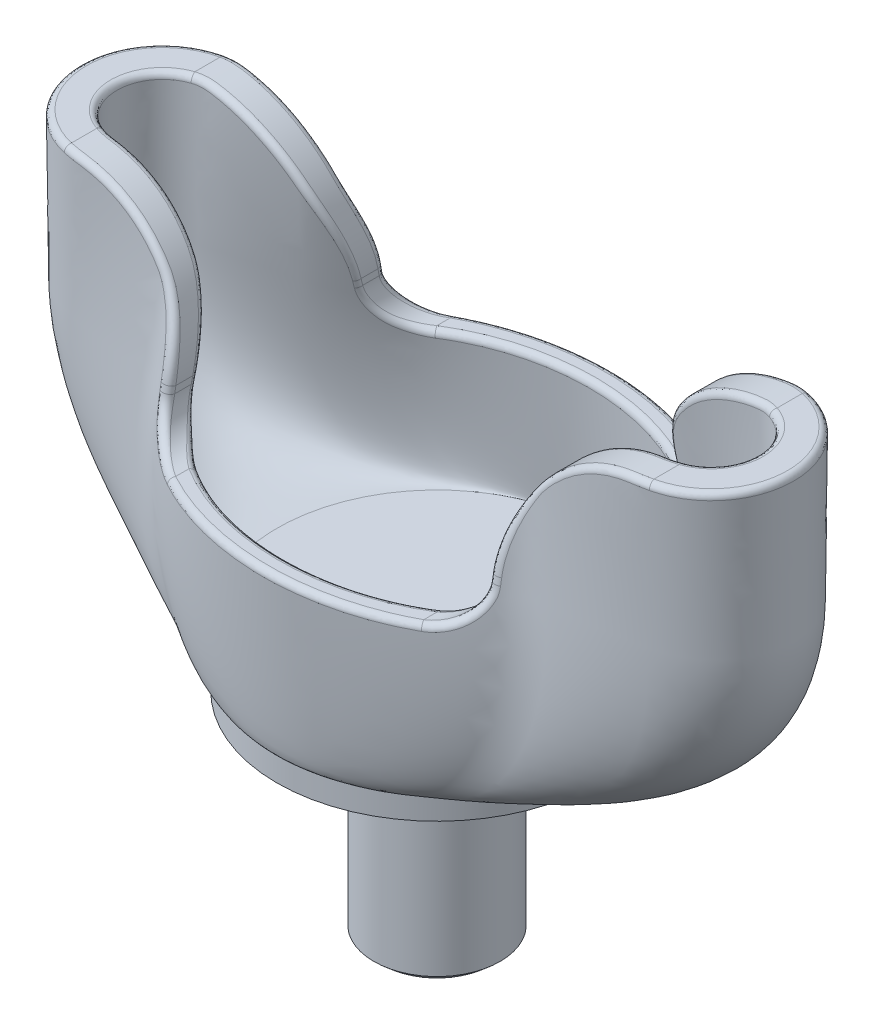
SolidWorks part; units mm, degrees
ref_plane "Front Plane" through (0, 0, 0) normal (0, 0, 1) x (1, 0, 0)
ref_plane "Top Plane" through (0, 0, 0) normal (0, 1, 0) x (1, 0, 0)
ref_plane "Right Plane" through (0, 0, 0) normal (1, 0, 0) x (0, 0, -1)
other "Configuration Table"
sketch "Sketch1" plane through (0, 0, 0) normal (0, 0, 1) x (1, 0, 0)
  line L0 (0, 10.7344) -> (0, -7.5424) construction
  line L1 (4.445, 5.334) -> (4.445, 6.5193)
  line L2 (-4.445, 0) -> (4.445, 0)
  line L3 (9.906, 10.16) -> (8.0857, 10.16)
  line L4 (-4.445, 5.334) -> (4.445, 5.334)
  line L5 (9.906, 10.16) -> (8.3762, 10.16) construction
  line L6 (9.906, 10.16) -> (9.906, 5.7504) construction
  line L7 (9.906, 10.16) -> (9.906, 6.1278)
  line L8 (4.445, 0) -> (4.445, 0.6667)
  line L9 (4.445, 0.6667) -> (0.3077, 0.6667) construction
  line L10 (-4.445, 0) -> (-4.445, 0.6667)
  line L11 (-9.906, 10.16) -> (-9.906, 6.1277)
  line L12 (-9.906, 10.16) -> (-8.0857, 10.16)
  line L13 (-4.445, 5.334) -> (-4.445, 6.5193)
  arc A5 (8.0857, 10.16) -> (4.445, 6.5193) centre (8.0857, 6.5193) ccw
  arc A6 (4.445, 0.6667) -> (9.906, 6.1278) centre (4.445, 6.1277) ccw
  arc A7 (-8.0857, 10.16) -> (-4.445, 6.5193) centre (-8.0857, 6.5193) cw
  arc A8 (-4.445, 0.6667) -> (-9.906, 6.1277) centre (-4.445, 6.1277) cw
  point P4 (0, 5.334)
  point P19 (0, 0)
ref_plane "Plane4" through (0, 10.16, 0) normal (0, 1, 0) x (-1, 0, 0)
ref_plane "Plane5" through (0, 0.6667, 0) normal (0, 1, 0) x (-1, 0, 0)
sketch "Sketch2" plane through (0, 10.16, 0) normal (0, 1, 0) x (-1, 0, 0)
  line L0 (4.445, 0) -> (-4.445, 0) construction
  line L1 (5.1243, -2.286) -> (7.62, -2.286)
  line L2 (0, 0) -> (14.2067, 0) construction
  line L3 (5.1243, 2.286) -> (7.62, 2.286)
  line L4 (0, 0) -> (0, 10.869) construction
  line L5 (0, 0) -> (0, -9.6836) construction
  line L6 (-5.1243, 2.286) -> (-7.62, 2.286)
  line L7 (-5.1243, -2.286) -> (-7.62, -2.286)
  arc A0 (4.2702, 2.7517) -> (-4.2702, 2.7517) centre (0, 0) ccw
  arc A1 (7.62, 2.286) -> (7.62, -2.286) centre (7.62, 0) cw
  arc A2 (-4.2702, -2.7517) -> (4.2702, -2.7517) centre (0, 0) ccw
  arc A3 (-7.62, 2.286) -> (-7.62, -2.286) centre (-7.62, 0) ccw
  arc A4 (-5.1243, 2.286) -> (-4.2702, 2.7517) centre (-5.1243, 3.302) ccw
  arc A5 (-5.1243, -2.286) -> (-4.2702, -2.7517) centre (-5.1243, -3.302) cw
  arc A6 (5.1243, 2.286) -> (4.2702, 2.7517) centre (5.1243, 3.302) cw
  arc A7 (5.1243, -2.286) -> (4.2702, -2.7517) centre (5.1243, -3.302) ccw
  point P20 (-4.5366, 2.286)
  point P23 (-4.5366, -2.286)
  point P26 (4.5366, 2.286)
  point P29 (4.5366, -2.286)
  dimension "F" = 10.16
  dimension "C" = 4.572
sketch "Sketch9" plane through (0, 0, 0) normal (0, 0, 1) x (1, 0, 0)
  line L0 (-9.906, 10.16) -> (-9.906, 6.1277) construction
  line L1 (-9.906, 10.16) -> (-9.906, 6.1277)
  arc A0 (-9.906, 6.1277) -> (-4.445, 0.6667) centre (-4.445, 6.1277) ccw construction
  arc A2 (-9.906, 6.1277) -> (-4.445, 0.6667) centre (-4.445, 6.1277) ccw
sketch "Sketch10" plane through (0, 0, 0) normal (0, 0, 1) x (1, 0, 0)
  line L0 (9.906, 10.16) -> (9.906, 6.1277) construction
  line L1 (9.906, 10.16) -> (9.906, 6.1277)
  arc A1 (4.445, 0.6668) -> (9.906, 6.1277) centre (4.445, 6.1277) ccw construction
  arc A2 (4.445, 0.6668) -> (9.906, 6.1277) centre (4.445, 6.1277) ccw
sketch "Sketch18" plane through (0, 0.6667, 0) normal (0, 1, 0) x (-1, 0, 0)
  circle A0 centre (0, 0) radius 4.445
loft "Loft2" add profiles "Sketch18", "Sketch2"
ref_plane "Plane6" through (0, 1.6827, 0) normal (0, 1, 0) x (-1, 0, 0)
sketch "Sketch20" plane through (0, 1.6827, 0) normal (0, 1, 0) x (-1, 0, 0)
  circle A0 centre (0, 0) radius 4.445 construction
  circle A1 centre (0, 0) radius 4.445
sketch "Sketch21" plane through (0, 10.16, 0) normal (0, 1, 0) x (-1, 0, 0)
  line L8 (-5.1243, 1.27) -> (-7.62, 1.27)
  line L9 (-7.62, -1.27) -> (-5.1243, -1.27)
  line L10 (5.1243, -1.27) -> (7.62, -1.27)
  line L11 (7.62, 1.27) -> (5.1243, 1.27)
  line L12 (-5.1243, 1.27) -> (-7.62, 1.27)
  line L13 (-7.62, -1.27) -> (-5.1243, -1.27)
  line L14 (5.1243, -1.27) -> (7.62, -1.27)
  line L15 (7.62, 1.27) -> (5.1243, 1.27)
  arc A16 (-7.62, 1.27) -> (-7.62, -1.27) centre (-7.62, 0) ccw
  arc A17 (-3.4162, -2.2013) -> (-5.1243, -1.27) centre (-5.1243, -3.302) ccw
  arc A18 (-3.4162, -2.2013) -> (3.4162, -2.2013) centre (0, 0) ccw
  arc A19 (5.1243, -1.27) -> (3.4162, -2.2013) centre (5.1243, -3.302) ccw
  arc A20 (7.62, -1.27) -> (7.62, 1.27) centre (7.62, 0) ccw
  arc A21 (3.4162, 2.2013) -> (5.1243, 1.27) centre (5.1243, 3.302) ccw
  arc A22 (3.4162, 2.2013) -> (-3.4162, 2.2013) centre (0, 0) ccw
  arc A23 (-5.1243, 1.27) -> (-3.4162, 2.2013) centre (-5.1243, 3.302) ccw
  arc A24 (-7.62, 1.27) -> (-7.62, -1.27) centre (-7.62, 0) ccw
  arc A25 (-3.4162, -2.2013) -> (-5.1243, -1.27) centre (-5.1243, -3.302) ccw
  arc A26 (-3.4162, -2.2013) -> (3.4162, -2.2013) centre (0, 0) ccw
  arc A27 (5.1243, -1.27) -> (3.4162, -2.2013) centre (5.1243, -3.302) ccw
  arc A28 (7.62, -1.27) -> (7.62, 1.27) centre (7.62, 0) ccw
  arc A29 (3.4162, 2.2013) -> (5.1243, 1.27) centre (5.1243, 3.302) ccw
  arc A30 (3.4162, 2.2013) -> (-3.4162, 2.2013) centre (0, 0) ccw
  arc A31 (-5.1243, 1.27) -> (-3.4162, 2.2013) centre (-5.1243, 3.302) ccw
sketch "Sketch22" plane through (0, 0, 0) normal (0, 0, 1) x (1, 0, 0)
  line L2 (-8.89, 10.16) -> (-8.89, 6.1277)
  line L3 (-8.89, 10.16) -> (-8.89, 6.1277)
  arc A2 (-8.89, 6.1277) -> (-4.445, 1.6827) centre (-4.445, 6.1277) ccw
  arc A3 (-8.89, 6.1277) -> (-4.445, 1.6827) centre (-4.445, 6.1277) ccw
sketch "Sketch23" plane through (0, 0, 0) normal (0, 0, 1) x (1, 0, 0)
  line L2 (8.89, 10.16) -> (8.89, 6.1277)
  line L3 (8.89, 10.16) -> (8.89, 6.1277)
  arc A2 (4.445, 1.6828) -> (8.89, 6.1277) centre (4.445, 6.1277) ccw
  arc A3 (4.445, 1.6828) -> (8.89, 6.1277) centre (4.445, 6.1277) ccw
loft "Cut-Loft1" cut profiles "Sketch20", "Sketch21"
sketch "Sketch14" plane through (0, 0, 0) normal (0, 0, 1) x (1, 0, 0)
  line L0 (0, 0) -> (0, -9.7552) construction
  line L2 (0, 0) -> (0, -6.35)
  line L3 (0, -6.35) -> (1.7526, -6.35)
  line L4 (1.7526, 0) -> (1.7526, -6.35)
  line L5 (1.7526, 0) -> (4.445, 0)
  line L6 (4.445, 0) -> (4.445, 0.6667)
  line L7 (4.445, 0.6667) -> (0, 0.6667)
  line L8 (0, 10.7344) -> (0, -7.5424) construction
  line L9 (6.9245, 0.6667) -> (-6.9245, 0.6667) construction
  line L10 (0, 0.6667) -> (0, 0)
revolve "Revolve1" add sketch "Sketch14" angle 360 about L0
sketch "Sketch16" plane through (0, 0, 0) normal (0, 0, 1) x (1, 0, 0)
  line L0 (-9.906, 10.16) -> (-9.906, 11.16)
  line L1 (-9.906, 11.16) -> (9.906, 11.16)
  line L2 (9.906, 11.16) -> (9.906, 10.16)
  line L10 (-4.445, 0) -> (4.445, 0)
  line L11 (4.445, 0) -> (4.445, 0.6667)
  line L12 (9.906, 6.1277) -> (9.906, 10.16)
  line L13 (9.906, 10.16) -> (8.0857, 10.16)
  line L14 (4.445, 6.5193) -> (4.445, 5.334)
  line L15 (4.445, 5.334) -> (-4.445, 5.334)
  line L16 (-4.445, 5.334) -> (-4.445, 6.5193)
  line L17 (-8.0857, 10.16) -> (-9.906, 10.16)
  line L18 (-9.906, 10.16) -> (-9.906, 6.1277)
  line L19 (-4.445, 0.6667) -> (-4.445, 0)
  line L23 (9.906, 10.16) -> (8.0857, 10.16)
  line L24 (4.445, 6.5193) -> (4.445, 5.334)
  line L25 (4.445, 5.334) -> (-4.445, 5.334)
  line L26 (-4.445, 5.334) -> (-4.445, 6.5193)
  line L27 (-8.0857, 10.16) -> (-9.906, 10.16)
  arc A4 (4.445, 0.6667) -> (9.906, 6.1277) centre (4.445, 6.1277) ccw
  arc A5 (8.0857, 10.16) -> (4.445, 6.5193) centre (8.0857, 6.5193) ccw
  arc A6 (-4.445, 6.5193) -> (-8.0857, 10.16) centre (-8.0857, 6.5193) ccw
  arc A7 (-9.906, 6.1277) -> (-4.445, 0.6667) centre (-4.445, 6.1277) ccw
  arc A9 (8.0857, 10.16) -> (4.445, 6.5193) centre (8.0857, 6.5193) ccw
  arc A10 (-4.445, 6.5193) -> (-8.0857, 10.16) centre (-8.0857, 6.5193) ccw
  dimension "D2" = 1
  dimension "D1" = 0
extrude "Cut-Extrude1" cut sketch "Sketch16" against normal through all and the other way through all
fillet "Fillet1" radius 1 4 edges at (4.445, 5.334, -2.924) (4.445, 5.334, 2.924) (-4.445, 5.334, -2.924) (-4.445, 5.334, 2.924)
fillet "Fillet2" radius 0.1693 32 edges at (-5.4656, 9.0471, -1.4153) (-5.968, 9.4808, 1.3386) (-4.1482, 5.623, -2.6418) (0.7192, 5.334, -4.1865) (4.2763, 5.7781, -2.5192) (5.4656, 9.0471, 1.4153) (5.968, 9.4808, -1.3386) (4.1482, 5.623, 2.6418) (-0.7192, 5.334, 4.1865) (-4.2763, 5.7781, 2.5192) (-5.3715, 8.9458, 2.3716) (-5.3444, 8.9152, -2.375) (-4.2761, 5.7779, -3.4455) (1.9112, 5.334, -4.5997) (4.1338, 5.609, -3.5649) (5.3444, 8.9152, 2.375) (5.3715, 8.9458, -2.3716) (4.2761, 5.7779, 3.4455) (-1.9112, 5.334, 4.5997) (-4.1338, 5.609, 3.5649)
sketch "Sketch27" plane through (0, 0, 0) normal (0, 0, 1) x (1, 0, 0)
  line L0 (0, 0) -> (0, -9.1725) construction
  line L1 (-4.445, 0) -> (4.445, 0) construction
  line L2 (-1.7526, -6.35) -> (1.7526, -6.35) construction
  line L4 (2.5146, -3.8354) -> (2.5146, -6.3754)
  line L5 (2.5146, -6.3754) -> (0, -6.3754)
  line L6 (0, -6.3754) -> (0, -6.35)
  arc A0 (0, -6.35) -> (2.5146, -3.8354) centre (0, -3.8354) ccw
  arc A1 (2.5146, -3.8354) -> (0, -6.35) centre (0, -3.8354) ccw construction
  dimension "D1" = 0.0254
  dimension "R" = 2.5146
revolve "Cut-Revolve11" cut sketch "Sketch27" angle 360 about L0
sketch "Sketch26" plane through (0, 0, 0) normal (0, 0, 1) x (1, 0, 0)
  line L0 (0, 0) -> (0, -6.8807) construction
  line L1 (-1.7526, 0) -> (1.7526, 0) construction
  line L2 (1.2802, -0.2753) -> (1.7526, -0.0025)
  line L3 (1.7526, -0.0025) -> (1.7526, -0.5481)
  line L4 (1.7526, -0.5481) -> (1.2802, -0.2753)
  line L9 (1.2802, -0.2753) -> (1.2802, -1.0678) construction
revolve "Cut-Revolve10" [suppressed] cut sketch "Sketch26" angle 360 about L0
pattern_linear "LPattern10" [suppressed] count 8 along (0, -1, 0)
equation "\"D1@Sketch1\" = (  \"A@Sketch1\" - \"EE@Sketch1\"  ) / 2 / 3"
equation "\"D2@Sketch1\" = \"G@Sketch1\" / 8"
equation "\"D1@LPattern10\" =\"L@Sketch14\" / \"pitch@Sketch26\" "
equation "\"EE@Sketch1\" = \"E@Sketch1\""
equation "\"LL@Cosmetic Thread1\" = \"L@Sketch14\""
equation "\"D1@Fillet2\" = \"T\" / 6"
equation "\"D1@Sketch26\" = \"d1@Sketch14\""
equation "\"D2@Sketch26\" = \"THD_MINOR@Cosmetic Thread1\""
equation "\"PITCH@LPattern10\" = \"pitch@Sketch26\""
